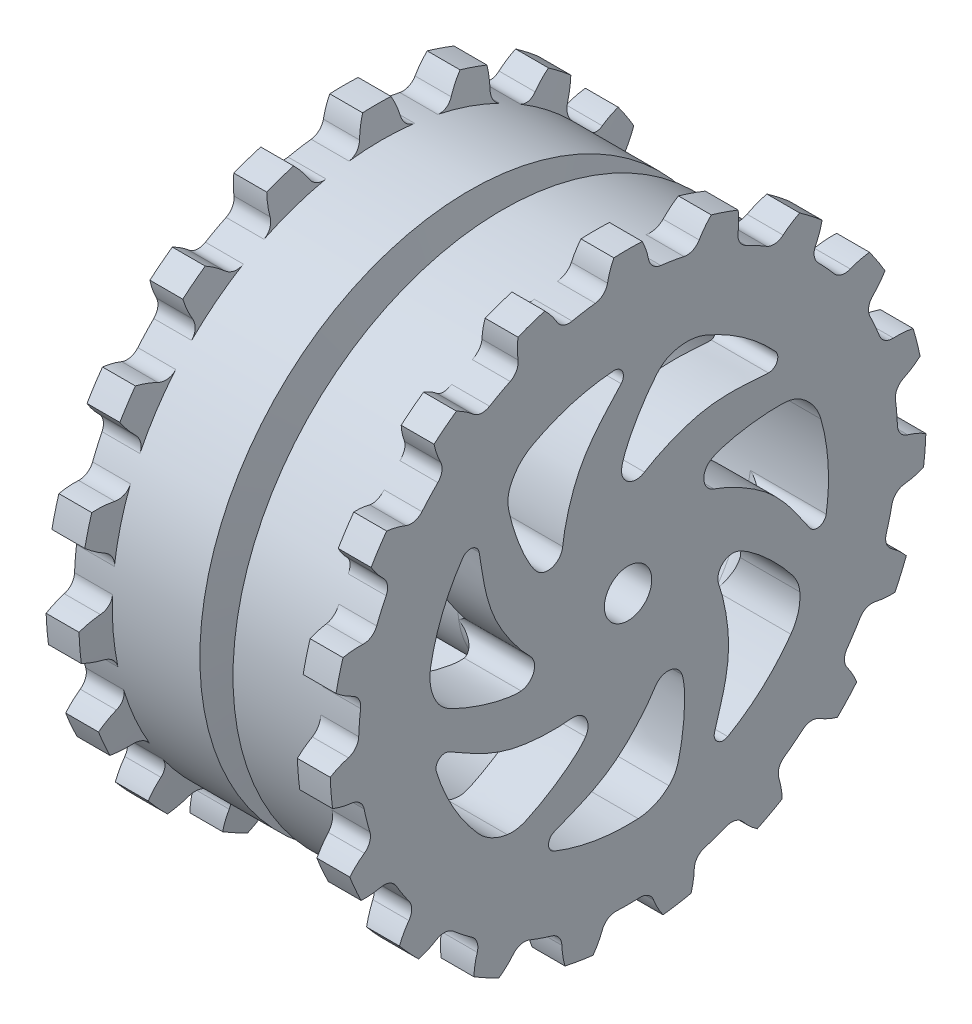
SolidWorks part; units mm, degrees
ref_plane "Plan de face" through (0, 0, 0) normal (0, 0, 1) x (1, 0, 0)
ref_plane "Plan de dessus" through (0, 0, 0) normal (0, 1, 0) x (1, 0, 0)
ref_plane "Plan de droite" through (0, 0, 0) normal (1, 0, 0) x (0, 0, -1)
sketch "Esquisse1" plane through (0, 0, 0) normal (1, 0, 0) x (0, 0, -1)
  circle A0 centre (0, 0) radius 28.465
  dimension "D1" = 56.93
extrude "Boss.-Extru.1" add sketch "Esquisse1" along normal mid plane 30
sketch "Esquisse3" plane through (0, 0, 0) normal (1, 0, 0) x (0, 0, -1)
  line L0 (-6, 31.465) -> (4, 31.465) construction
  line L1 (-6, 28.465) -> (4, 28.465) construction
  line L2 (0, 29.965) -> (0, 0) construction
  line L3 (-2.5, 29.965) -> (2.5, 29.965) construction
  line L4 (0, 28.465) -> (0, 31.465) construction
  arc A0 (4, 31.465) -> (4, 28.465) centre (4, 29.965) cw construction
  arc A1 (-6, 31.465) -> (-6, 28.465) centre (-6, 29.965) ccw construction
  arc A2 (4, 31.465) -> (4, 28.465) centre (4, 29.965) ccw construction
  arc A3 (-4, 31.465) -> (-4, 28.465) centre (-4, 29.965) cw construction
  circle A4 centre (0, 0) radius 28.465 construction
  arc A5 (-2.3095, 28.3712) -> (2.3095, 28.3712) centre (0, 0) cw
  arc A6 (-1.5, 31.4292) -> (1.5, 31.4292) centre (0, 0) cw
  arc A7 (-1.5, 31.4292) -> (-2.3095, 28.3712) centre (5.6762, 27.8933) ccw
  arc A8 (1.5, 31.4292) -> (2.3095, 28.3712) centre (-5.6762, 27.8933) cw
  point P25 (-2.9738, 28.3092)
  point P26 (-1.4385, 31.465)
  point P30 (-1.3775, 29.756)
  point P31 (1.205, 29.7365)
  point P32 (-1.1232, 29.0181)
  point P33 (-1.0855, 28.8327)
  point P34 (-7.3338, 28.0172)
  point P35 (-7.352, 28.126)
  point P36 (2.9019, 28.3167)
  point P37 (-1.7979, 31.5163)
  point P38 (-1.8207, 31.8362)
  point P39 (-1.7581, 31.465)
  point P40 (-1.7294, 31.465)
  point P41 (1.5, 31.465)
  point P42 (-2.3095, 28.3712)
  point P43 (-1.5, 31.465)
  point P44 (0, 29.9406)
  point P45 (12.4563, 7.4331)
  dimension "D5" = 8
  dimension "D1" = 3
  dimension "D2" = 10
  dimension "D3" = 2
  dimension "D4" = 3
  dimension "D6" = 3
extrude "Boss.-Extru.3" add sketch "Esquisse3" along normal mid plane 30
fillet "Congé1" radius 1.5 2 edges at (0, 28.3712, -2.3095) (0, 28.3712, 2.3095)
pattern_circular "Répétition circulaire1" count 19 over 360 about axis through (0, 0, 0) along (1, 0, 0) of "Boss.-Extru.3", "Congé1"
sketch "Esquisse4" plane through (0, 0, 0) normal (0, 0, 1) x (1, 0, 0)
  line L0 (0, 0) -> (0, 43.1798) construction
  line L1 (11.5352, 31.5) -> (-11.5352, 31.5)
  line L2 (-11.5352, 31.5) -> (-11, 28.465)
  line L3 (-11, 28.465) -> (-1.75, 28.465)
  line L4 (-1.75, 28.465) -> (-1.1457, 24.165)
  line L5 (-1.1457, 24.165) -> (1.1457, 24.165)
  line L6 (0, 0) -> (-29.2825, 0) construction
  line L7 (-15, 29.2393) -> (-15, 27.1502) construction
  line L11 (11.5352, 31.5) -> (11, 28.465)
  line L12 (11, 28.465) -> (1.75, 28.465)
  line L13 (1.75, 28.465) -> (1.1457, 24.165)
  point P9 (-11.4182, 31.5)
  point P12 (-11.5038, 31.4292)
  point P13 (-11.9689, 31.465)
  point P14 (0, 0)
  point P15 (0, 0)
  point P16 (-12.0171, 31.5)
  point P18 (0, 31.5)
  point P21 (0, 24.165)
  dimension "D1" = 63
  dimension "D2" = 4
  dimension "D3" = 3.5
  dimension "D4" = 100
  dimension "D5" = 56.93
  dimension "D6" = 4.3
  dimension "D7" = 98
revolve "Enlèvement de matière-Révolution1" cut sketch "Esquisse4" angle 360 about L6
sketch "Esquisse5" plane through (0, 0, 0) normal (0, 0, 1) x (1, 0, 0)
  line L0 (-15, 25) -> (-6, 25)
  line L1 (-6, 25) -> (-6, 21.165)
  line L2 (-6, 21.165) -> (9, 21.165)
  line L3 (-15, 25) -> (-15, 0)
  line L4 (-15, 0) -> (15, 0)
  line L5 (-15, 12.5571) -> (-15, 10.2898) construction
  line L6 (0, 0) -> (-31.683, 0) construction
  line L8 (1.1457, 24.165) -> (-1.1457, 24.165) construction
  line L9 (-3, 10) -> (-3, 2)
  line L10 (-3, 10) -> (9, 10)
  line L11 (9, 21.165) -> (9, 10)
  line L12 (-3, 2) -> (5, 2)
  line L13 (15, 1.1147) -> (15, 3.5821) construction
  line L15 (5, 2) -> (5, 2.5)
  line L16 (5, 2.5) -> (15, 2.5)
  line L17 (15, 0) -> (15, 2.5)
  point P14 (14.7305, 0)
  dimension "D1" = 50
  dimension "D2" = 3
  dimension "D3" = 3
  dimension "D4" = 9
  dimension "D5" = 12
  dimension "D6" = 8
  dimension "D7" = 5
  dimension "D8" = 20
  dimension "D9" = 6
  dimension "D10" = 4
revolve "Enlèvement de matière-Révolution2" cut sketch "Esquisse5" angle 360 about L6
sketch "Esquisse6" plane through (-3, 0, 0) normal (-1, 0, 0) x (0, 0, 1)
  line L1 (7.5056, 0) -> (3.7528, 6.5)
  line L2 (3.7528, 6.5) -> (-3.7528, 6.5)
  line L3 (-3.7528, 6.5) -> (-7.5056, 0)
  line L4 (-7.5056, 0) -> (-3.7528, -6.5)
  line L5 (-3.7528, -6.5) -> (3.7528, -6.5)
  line L6 (3.7528, -6.5) -> (7.5056, 0)
  circle A0 centre (0, 0) radius 6.5 construction
  dimension "D1" = 13
extrude "Enlèv. mat.-Extru.1" cut sketch "Esquisse6" against normal blind 5
fillet "Congé2" radius 2 2 edges at (9, 0, -21.165) (9, 0, -10)
sketch "Esquisse7" plane through (15, 0, 0) normal (1, 0, 0) x (0, 0, -1)
  arc A0 (4.6768, 19.6698) -> (8.2039, 19.5103) centre (6.2239, 14.8015) cw
  circle A1 centre (0, 0) radius 21.165 construction
  arc A2 (-0.6794, 11.7392) -> (1.7373, 10.2191) centre (0.8818, 11.5402) ccw
  circle A3 centre (0, 0) radius 10 construction
  circle A4 centre (0, 0) radius 21.165 construction
  arc A5 (15.5579, 14.3495) -> (14.8186, 12.7446) centre (14.8546, 13.7008) cw
  arc A6 (15.5579, 14.3495) -> (8.2039, 19.5103) centre (0, 0) ccw
  spline S0 degree 3 poles (-0.6794, 11.7392) (-0.4893, 13.2306) (1.7006, 17.1547) (3.7551, 19.3769) (4.6768, 19.6698) knots 0 0 0 0 0.737877 1 1 1 1
  spline S1 degree 3 poles (1.7373, 10.2191) (2.9017, 10.9732) (8.3197, 13.5583) (12.8912, 12.8171) (14.8186, 12.7446) knots 0 0 0 0 0.437501 1 1 1 1
  point P7 (2.2074, 10.4113)
  point P8 (13.6869, 13.4152)
  point P14 (14.8186, 12.7446)
  point P15 (15.5579, 14.3495)
  point P16 (13.583, 13.5204)
  point P17 (7.0215, 13.2762)
  point P18 (7.4804, 12.5985)
  point P19 (1.7373, 10.2191)
extrude "Enlèv. mat.-Extru.2" cut sketch "Esquisse7" against normal through all
pattern_circular "Répétition circulaire2" count 7 over 360 about axis through (15, 0, 0) along (1, 0, 0) of "Enlèv. mat.-Extru.2"
fillet "Congé3" radius 3 1 edges at (-6, 0, -21.165)
